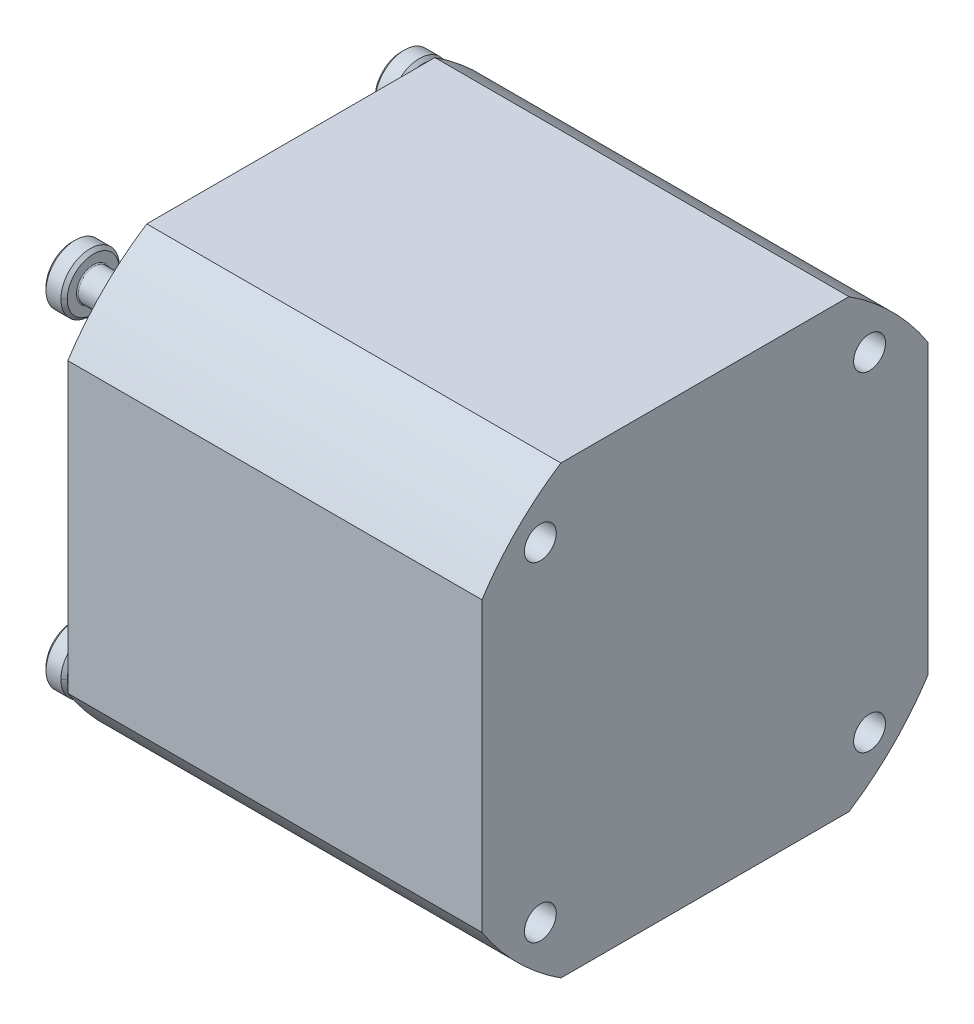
SolidWorks part; units mm, degrees
ref_plane "Plan de face" through (0, 0, 0) normal (0, 0, 1) x (1, 0, 0)
ref_plane "Plan de dessus" through (0, 0, 0) normal (0, 1, 0) x (1, 0, 0)
ref_plane "Plan de droite" through (0, 0, 0) normal (1, 0, 0) x (0, 0, -1)
imported_body "Importée6"
imported_body "Importée7"
imported_body "Importée8"
imported_body "Importée9"
imported_body "Importée10"
ref_plane "Plan1" through (0, 0, -75.8652) normal (0, 0, 1) x (1, 0, 0)
sketch "Esquisse1" plane through (0, 0, -75.8652) normal (0, 0, 1) x (1, 0, 0)
  line L0 (11.7492, 153.1934) -> (84.4847, 153.1934) construction
  line L1 (16.9872, 153.1934) -> (37.0572, 153.1934) construction
  line L2 (39.0572, 153.1934) -> (78.0572, 153.1934) construction
  line L3 (15.9872, 153.1934) -> (74.0572, 153.1934)
  line L4 (74.0572, 153.1934) -> (74.0572, 169.1934)
  line L5 (74.0572, 169.1934) -> (43.0572, 169.1934)
  line L6 (43.0572, 169.1934) -> (43.0572, 161.1934)
  line L7 (43.0572, 161.1934) -> (40.0572, 161.1934)
  line L8 (40.0572, 161.1934) -> (40.0572, 157.1934)
  line L9 (40.0572, 157.1934) -> (15.9872, 157.1934)
  line L10 (15.9872, 157.1934) -> (15.9872, 153.1934)
  line L11 (78.0572, 166.7581) -> (78.0572, 139.6287) construction
  line L12 (39.0572, 166.7581) -> (39.0572, 139.6287) construction
  line L13 (37.0572, 164.1934) -> (37.0572, 142.1934) construction
  line L14 (16.9872, 155.6934) -> (16.9872, 150.6934) construction
  dimension "D1" = 4
  dimension "D2" = 4
  dimension "D3" = 32
  dimension "D4" = 16
  dimension "D5" = 3
  dimension "D6" = 4
  dimension "D7" = 1
revolve "Enlèvement de matière-Révolution1" cut sketch "Esquisse1" angle 360 about L0
